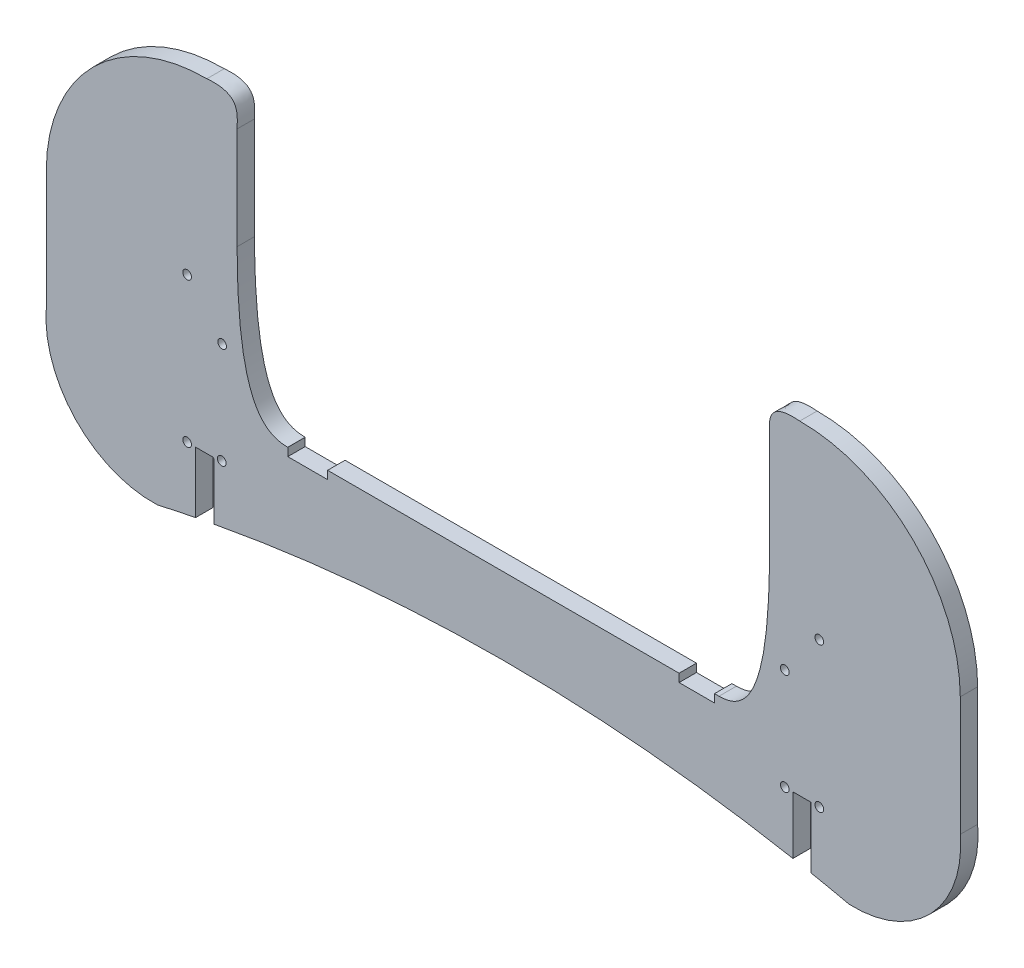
SolidWorks part; units mm, degrees
ref_plane "Front Plane" through (0, 0, 0) normal (0, 0, 1) x (1, 0, 0)
ref_plane "Top Plane" through (0, 0, 0) normal (0, 1, 0) x (1, 0, 0)
ref_plane "Right Plane" through (0, 0, 0) normal (1, 0, 0) x (0, 0, -1)
sketch "Model" plane through (0, 0, 0) normal (0, 0, 1) x (1, 0, 0)
  line L1 (258.6958, 176.1646) -> (137.4544, 176.1646)
  line L11 (137.4544, 176.1646) -> (137.4544, 173.3695)
  line L12 (137.4544, 173.3695) -> (123.7117, 173.3695)
  line L13 (123.7117, 173.3695) -> (123.7117, 176.1646)
  line L14 (106.2443, 227.3686) -> (106.2443, 262.5496)
  line L15 (198.0282, 149.6917) -> (198.0826, 149.6917)
  line L38 (289.8666, 227.3686) -> (289.8666, 262.5496)
  line L39 (270.9108, 173.3695) -> (270.9108, 176.1646)
  line L40 (258.6958, 173.3695) -> (270.9108, 173.3695)
  line L41 (258.6958, 176.1646) -> (258.6958, 173.3695)
  arc A76 (78.7264, 136.4553) -> (317.3844, 136.4553) centre (198.0554, -394.8135) cw
  arc A77 (40.4105, 176.5129) -> (78.7264, 136.4553) centre (77.2271, 173.3749) ccw
  arc A78 (40.4105, 217.6155) -> (95.7945, 272.3028) centre (95.4897, 217.223) cw
  arc A79 (355.7003, 176.5129) -> (317.3844, 136.4553) centre (318.8838, 173.3749) cw
  arc A80 (355.7003, 217.6155) -> (300.3164, 272.3028) centre (300.6211, 217.223) ccw
  spline S14 degree 2 poles (355.7003, 217.6155) (355.7003, 183.1311) (355.7003, 176.5129) knots 16 16 16 17 17 17
  spline S16 degree 3 poles (289.8666, 262.5496) (289.8666, 266.7295) (288.4733, 273.3477) (300.3164, 272.3028) knots 14 14 14 14 15 15 15 15
  spline S17 degree 3 poles (272.4584, 176.1646) (281.5144, 176.1659) (289.8728, 183.4816) (289.8666, 227.3686) knots 12 12 12 12 13 13 13 13
  spline S18 degree 2 poles (270.9108, 176.1646) (271.9077, 176.1646) (272.4584, 176.1646) knots 11 11 11 12 12 12
  spline S21 degree 2 poles (123.7117, 176.1646) (123.6788, 176.1646) (123.6606, 176.1646) knots 11 11 11 12 12 12
  spline S22 degree 3 poles (123.6606, 176.1646) (114.6041, 176.1646) (106.2443, 183.4794) (106.2443, 227.3686) knots 12 12 12 12 13 13 13 13
  spline S23 degree 3 poles (106.2443, 262.5496) (106.2443, 266.7295) (107.6376, 273.3477) (95.7945, 272.3028) knots 14 14 14 14 15 15 15 15
  spline S25 degree 2 poles (40.4105, 217.6155) (40.4105, 183.1311) (40.4105, 176.5129) knots 16 16 16 17 17 17
  point P180 (198.0751, 176.1646)
  dimension "D4" = 183.6223
extrude "Boss-Extrude1" add sketch "Model" along normal blind 6
sketch "Sketch1" plane through (0, 0, 6) normal (0, 0, 1) x (1, 0, 0)
  line L0 (198.0751, 176.1646) -> (198.0751, 150.4892) construction
  line L1 (258.6958, 176.1646) -> (137.4544, 176.1646) construction
sketch "Sketch2" plane through (0, 0, 0) normal (0, 0, -1) x (-1, 0, 0)
  circle A0 centre (-88.9935, 160.3663) radius 1.5
  circle A1 centre (-88.9935, 210.3663) radius 1.5
  circle A2 centre (-307.0629, 160.3663) radius 1.5
  circle A3 centre (-307.0629, 210.3663) radius 1.5
extrude "Cut-Extrude1" cut sketch "Sketch2" against normal blind 10
sketch "Sketch3" plane through (0, 0, 0) normal (0, 0, -1) x (-1, 0, 0)
  line L0 (-307.0629, 160.3663) -> (-295.1629, 160.3663) construction
  line L1 (-307.0629, 210.3663) -> (-295.1629, 210.3663) construction
  line L2 (-295.1629, 210.3663) -> (-295.1629, 160.3663) construction
  line L3 (-198.0751, 176.1646) -> (-198.0282, 149.6917) construction
  line L4 (-258.6958, 176.1646) -> (-137.4544, 176.1646) construction
  circle A0 centre (-100.9319, 160.7103) radius 1.5
  circle A1 centre (-101.0559, 195.7101) radius 1.5
  circle A2 centre (-295.1629, 160.3663) radius 1.5
  circle A3 centre (-295.1629, 195.3663) radius 1.5
  circle A4 centre (-307.0629, 160.3663) radius 1.5 construction
  dimension "D3" = 35
  dimension "D4" = 11.9
extrude "Cut-Extrude2" cut sketch "Sketch3" against normal blind 10
sketch "Sketch4" plane through (0, 0, 0) normal (0, 0, -1) x (-1, 0, 0)
  circle A0 centre (-307.0629, 210.3663) radius 2.85
  circle A1 centre (-295.1629, 195.3663) radius 2.85
  circle A2 centre (-307.0629, 160.3663) radius 2.85
  circle A3 centre (-295.1629, 160.3663) radius 2.85
  circle A4 centre (-88.9935, 210.3663) radius 2.85
  circle A5 centre (-101.0559, 195.7101) radius 2.85
  circle A6 centre (-100.9319, 160.7103) radius 2.85
  circle A7 centre (-88.9935, 160.3663) radius 2.85
  dimension "D1" = 5.7
extrude "Cut-Extrude3" cut sketch "Sketch4" against normal blind 3
sketch "Sketch5" plane through (0, 0, 0) normal (0, 0, -1) x (-1, 0, 0)
  line L0 (-307.0629, 160.3663) -> (-295.1629, 160.3663) construction
  line L1 (-304.2629, 160.3663) -> (-304.2629, 138.6172)
  line L2 (-304.2629, 138.6172) -> (-297.9629, 139.8501)
  line L3 (-198.0751, 176.1646) -> (-198.0826, 149.6917) construction
  line L4 (-292.047, 136.445) -> (-292.0887, 136.445)
  line L5 (-304.2629, 160.3663) -> (-297.9629, 160.3663)
  line L6 (-297.9629, 139.8501) -> (-297.9629, 160.3663)
  line L7 (-258.6958, 176.1646) -> (-137.4544, 176.1646) construction
  line L8 (-304.2629, 150.1082) -> (-301.1129, 150.1082) construction
  line L9 (-301.1129, 150.1082) -> (-297.9629, 150.1082) construction
  line L10 (-95.0521, 150.0495) -> (-98.2021, 150.0513) construction
  line L11 (-91.9021, 150.0477) -> (-95.0521, 150.0495) construction
  line L12 (-89.0963, 160.3043) -> (-100.9963, 160.311) construction
  line L13 (-98.208, 139.7932) -> (-98.1963, 160.3094)
  line L14 (-91.8963, 160.3059) -> (-98.1963, 160.3094)
  line L15 (-104.1258, 136.3915) -> (-104.0841, 136.3914)
  line L16 (-91.9087, 138.5567) -> (-98.208, 139.7932)
  line L17 (-91.8963, 160.3059) -> (-91.9087, 138.5567)
  circle A0 centre (-307.0629, 160.3663) radius 2.85 construction
  point P9 (-301.1129, 150.1082)
  dimension "D1" = 6.3
  dimension "D2" = 2.8
extrude "Cut-Extrude5" cut sketch "Sketch5" against normal blind 6
